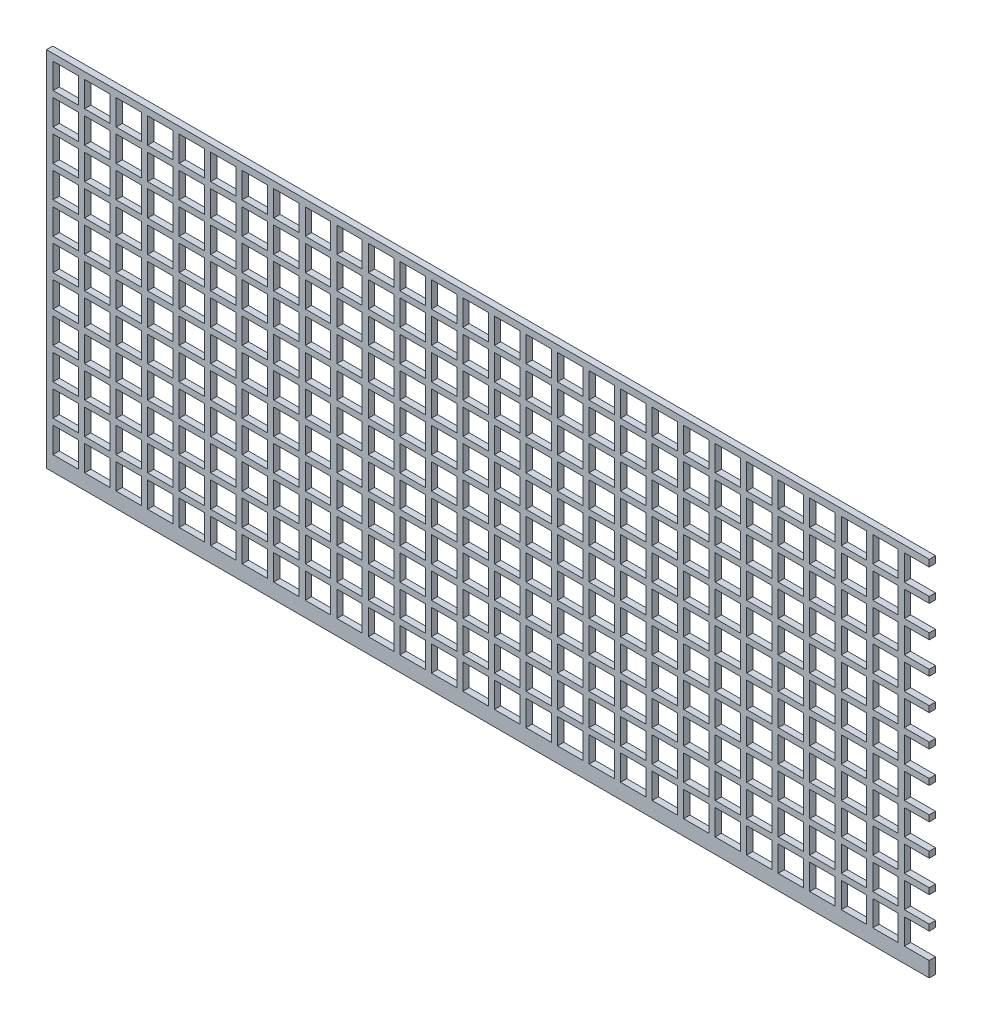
SolidWorks part; units mm, degrees
ref_plane "Front Plane" through (0, 0, 0) normal (0, 0, 1) x (1, 0, 0)
ref_plane "Top Plane" through (0, 0, 0) normal (0, 1, 0) x (1, 0, 0)
ref_plane "Right Plane" through (0, 0, 0) normal (1, 0, 0) x (0, 0, -1)
sketch "Sketch1" plane through (0, 0, 0) normal (0, 0, 1) x (1, 0, 0)
  line L0 (15.3541, 143.3482) -> (25.6075, 143.3482)
  line L1 (0, 0) -> (355.6, 0)
  line L2 (0, 0) -> (0, 146.05)
  line L3 (0, 146.05) -> (355.6, 146.05)
  line L4 (355.6, 0) -> (355.6, 146.05)
  line L5 (2.6541, 143.3482) -> (12.9075, 143.3482)
  line L6 (2.6541, 143.3482) -> (2.6541, 133.0948)
  line L7 (2.6541, 133.0948) -> (12.9075, 133.0948)
  line L8 (12.9075, 143.3482) -> (12.9075, 133.0948)
  line L9 (15.3541, 143.3482) -> (15.3541, 133.0948)
  line L10 (15.3541, 133.0948) -> (25.6075, 133.0948)
  line L11 (25.6075, 143.3482) -> (25.6075, 133.0948)
  line L12 (28.0541, 143.3482) -> (38.3075, 143.3482)
  line L13 (28.0541, 143.3482) -> (28.0541, 133.0948)
  line L14 (28.0541, 133.0948) -> (38.3075, 133.0948)
  line L15 (38.3075, 143.3482) -> (38.3075, 133.0948)
  line L16 (40.7541, 143.3482) -> (51.0075, 143.3482)
  line L17 (40.7541, 143.3482) -> (40.7541, 133.0948)
  line L18 (40.7541, 133.0948) -> (51.0075, 133.0948)
  line L19 (51.0075, 143.3482) -> (51.0075, 133.0948)
  line L20 (53.4541, 143.3482) -> (63.7075, 143.3482)
  line L21 (53.4541, 143.3482) -> (53.4541, 133.0948)
  line L22 (53.4541, 133.0948) -> (63.7075, 133.0948)
  line L23 (63.7075, 143.3482) -> (63.7075, 133.0948)
  line L24 (66.1541, 143.3482) -> (76.4075, 143.3482)
  line L25 (66.1541, 143.3482) -> (66.1541, 133.0948)
  line L26 (66.1541, 133.0948) -> (76.4075, 133.0948)
  line L27 (76.4075, 143.3482) -> (76.4075, 133.0948)
  line L28 (78.8541, 143.3482) -> (89.1075, 143.3482)
  line L29 (78.8541, 143.3482) -> (78.8541, 133.0948)
  line L30 (78.8541, 133.0948) -> (89.1075, 133.0948)
  line L31 (89.1075, 143.3482) -> (89.1075, 133.0948)
  line L32 (91.5541, 143.3482) -> (101.8075, 143.3482)
  line L33 (91.5541, 143.3482) -> (91.5541, 133.0948)
  line L34 (91.5541, 133.0948) -> (101.8075, 133.0948)
  line L35 (101.8075, 143.3482) -> (101.8075, 133.0948)
  line L36 (104.2541, 143.3482) -> (114.5075, 143.3482)
  line L37 (104.2541, 143.3482) -> (104.2541, 133.0948)
  line L38 (104.2541, 133.0948) -> (114.5075, 133.0948)
  line L39 (114.5075, 143.3482) -> (114.5075, 133.0948)
  line L40 (116.9541, 143.3482) -> (127.2075, 143.3482)
  line L41 (116.9541, 143.3482) -> (116.9541, 133.0948)
  line L42 (116.9541, 133.0948) -> (127.2075, 133.0948)
  line L43 (127.2075, 143.3482) -> (127.2075, 133.0948)
  line L44 (129.6541, 143.3482) -> (139.9075, 143.3482)
  line L45 (129.6541, 143.3482) -> (129.6541, 133.0948)
  line L46 (129.6541, 133.0948) -> (139.9075, 133.0948)
  line L47 (139.9075, 143.3482) -> (139.9075, 133.0948)
  line L48 (142.3541, 143.3482) -> (152.6075, 143.3482)
  line L49 (142.3541, 143.3482) -> (142.3541, 133.0948)
  line L50 (142.3541, 133.0948) -> (152.6075, 133.0948)
  line L51 (152.6075, 143.3482) -> (152.6075, 133.0948)
  line L52 (155.0541, 143.3482) -> (165.3075, 143.3482)
  line L53 (155.0541, 143.3482) -> (155.0541, 133.0948)
  line L54 (155.0541, 133.0948) -> (165.3075, 133.0948)
  line L55 (165.3075, 143.3482) -> (165.3075, 133.0948)
  line L56 (167.7541, 143.3482) -> (178.0075, 143.3482)
  line L57 (167.7541, 143.3482) -> (167.7541, 133.0948)
  line L58 (167.7541, 133.0948) -> (178.0075, 133.0948)
  line L59 (178.0075, 143.3482) -> (178.0075, 133.0948)
  line L60 (180.4541, 143.3482) -> (190.7075, 143.3482)
  line L61 (180.4541, 143.3482) -> (180.4541, 133.0948)
  line L62 (180.4541, 133.0948) -> (190.7075, 133.0948)
  line L63 (190.7075, 143.3482) -> (190.7075, 133.0948)
  line L64 (193.1541, 143.3482) -> (203.4075, 143.3482)
  line L65 (193.1541, 143.3482) -> (193.1541, 133.0948)
  line L66 (193.1541, 133.0948) -> (203.4075, 133.0948)
  line L67 (203.4075, 143.3482) -> (203.4075, 133.0948)
  line L68 (205.8541, 143.3482) -> (216.1075, 143.3482)
  line L69 (205.8541, 143.3482) -> (205.8541, 133.0948)
  line L70 (205.8541, 133.0948) -> (216.1075, 133.0948)
  line L71 (216.1075, 143.3482) -> (216.1075, 133.0948)
  line L72 (218.5541, 143.3482) -> (228.8075, 143.3482)
  line L73 (218.5541, 143.3482) -> (218.5541, 133.0948)
  line L74 (218.5541, 133.0948) -> (228.8075, 133.0948)
  line L75 (228.8075, 143.3482) -> (228.8075, 133.0948)
  line L76 (231.2541, 143.3482) -> (241.5075, 143.3482)
  line L77 (231.2541, 143.3482) -> (231.2541, 133.0948)
  line L78 (231.2541, 133.0948) -> (241.5075, 133.0948)
  line L79 (241.5075, 143.3482) -> (241.5075, 133.0948)
  line L80 (243.9541, 143.3482) -> (254.2075, 143.3482)
  line L81 (243.9541, 143.3482) -> (243.9541, 133.0948)
  line L82 (243.9541, 133.0948) -> (254.2075, 133.0948)
  line L83 (254.2075, 143.3482) -> (254.2075, 133.0948)
  line L84 (256.6541, 143.3482) -> (266.9075, 143.3482)
  line L85 (256.6541, 143.3482) -> (256.6541, 133.0948)
  line L86 (256.6541, 133.0948) -> (266.9075, 133.0948)
  line L87 (266.9075, 143.3482) -> (266.9075, 133.0948)
  line L88 (269.3541, 143.3482) -> (279.6075, 143.3482)
  line L89 (269.3541, 143.3482) -> (269.3541, 133.0948)
  line L90 (269.3541, 133.0948) -> (279.6075, 133.0948)
  line L91 (279.6075, 143.3482) -> (279.6075, 133.0948)
  line L92 (282.0541, 143.3482) -> (292.3075, 143.3482)
  line L93 (282.0541, 143.3482) -> (282.0541, 133.0948)
  line L94 (282.0541, 133.0948) -> (292.3075, 133.0948)
  line L95 (292.3075, 143.3482) -> (292.3075, 133.0948)
  line L96 (294.7541, 143.3482) -> (305.0075, 143.3482)
  line L97 (294.7541, 143.3482) -> (294.7541, 133.0948)
  line L98 (294.7541, 133.0948) -> (305.0075, 133.0948)
  line L99 (305.0075, 143.3482) -> (305.0075, 133.0948)
  line L100 (307.4541, 143.3482) -> (317.7075, 143.3482)
  line L101 (307.4541, 143.3482) -> (307.4541, 133.0948)
  line L102 (307.4541, 133.0948) -> (317.7075, 133.0948)
  line L103 (317.7075, 143.3482) -> (317.7075, 133.0948)
  line L104 (320.1541, 143.3482) -> (330.4075, 143.3482)
  line L105 (320.1541, 143.3482) -> (320.1541, 133.0948)
  line L106 (320.1541, 133.0948) -> (330.4075, 133.0948)
  line L107 (330.4075, 143.3482) -> (330.4075, 133.0948)
  line L108 (332.8541, 143.3482) -> (343.1075, 143.3482)
  line L109 (332.8541, 143.3482) -> (332.8541, 133.0948)
  line L110 (332.8541, 133.0948) -> (343.1075, 133.0948)
  line L111 (343.1075, 143.3482) -> (343.1075, 133.0948)
  line L112 (345.5541, 143.3482) -> (355.8075, 143.3482)
  line L113 (345.5541, 143.3482) -> (345.5541, 133.0948)
  line L114 (345.5541, 133.0948) -> (355.8075, 133.0948)
  line L115 (355.8075, 143.3482) -> (355.8075, 133.0948)
  line L116 (15.3541, 130.6482) -> (25.6075, 130.6482)
  line L117 (15.3541, 130.6482) -> (15.3541, 120.3948)
  line L118 (15.3541, 120.3948) -> (25.6075, 120.3948)
  line L119 (25.6075, 130.6482) -> (25.6075, 120.3948)
  line L120 (28.0541, 130.6482) -> (38.3075, 130.6482)
  line L121 (28.0541, 130.6482) -> (28.0541, 120.3948)
  line L122 (28.0541, 120.3948) -> (38.3075, 120.3948)
  line L123 (38.3075, 130.6482) -> (38.3075, 120.3948)
  line L124 (40.7541, 130.6482) -> (51.0075, 130.6482)
  line L125 (40.7541, 130.6482) -> (40.7541, 120.3948)
  line L126 (40.7541, 120.3948) -> (51.0075, 120.3948)
  line L127 (51.0075, 130.6482) -> (51.0075, 120.3948)
  line L128 (53.4541, 130.6482) -> (63.7075, 130.6482)
  line L129 (53.4541, 130.6482) -> (53.4541, 120.3948)
  line L130 (53.4541, 120.3948) -> (63.7075, 120.3948)
  line L131 (63.7075, 130.6482) -> (63.7075, 120.3948)
  line L132 (66.1541, 130.6482) -> (76.4075, 130.6482)
  line L133 (66.1541, 130.6482) -> (66.1541, 120.3948)
  line L134 (66.1541, 120.3948) -> (76.4075, 120.3948)
  line L135 (76.4075, 130.6482) -> (76.4075, 120.3948)
  line L136 (78.8541, 130.6482) -> (89.1075, 130.6482)
  line L137 (78.8541, 130.6482) -> (78.8541, 120.3948)
  line L138 (78.8541, 120.3948) -> (89.1075, 120.3948)
  line L139 (89.1075, 130.6482) -> (89.1075, 120.3948)
  line L140 (91.5541, 130.6482) -> (101.8075, 130.6482)
  line L141 (91.5541, 130.6482) -> (91.5541, 120.3948)
  line L142 (91.5541, 120.3948) -> (101.8075, 120.3948)
  line L143 (101.8075, 130.6482) -> (101.8075, 120.3948)
  line L144 (104.2541, 130.6482) -> (114.5075, 130.6482)
  line L145 (104.2541, 130.6482) -> (104.2541, 120.3948)
  line L146 (104.2541, 120.3948) -> (114.5075, 120.3948)
  line L147 (114.5075, 130.6482) -> (114.5075, 120.3948)
  line L148 (116.9541, 130.6482) -> (127.2075, 130.6482)
  line L149 (116.9541, 130.6482) -> (116.9541, 120.3948)
  line L150 (116.9541, 120.3948) -> (127.2075, 120.3948)
  line L151 (127.2075, 130.6482) -> (127.2075, 120.3948)
  line L152 (129.6541, 130.6482) -> (139.9075, 130.6482)
  line L153 (129.6541, 130.6482) -> (129.6541, 120.3948)
  line L154 (129.6541, 120.3948) -> (139.9075, 120.3948)
  line L155 (139.9075, 130.6482) -> (139.9075, 120.3948)
  line L156 (142.3541, 130.6482) -> (152.6075, 130.6482)
  line L157 (142.3541, 130.6482) -> (142.3541, 120.3948)
  line L158 (142.3541, 120.3948) -> (152.6075, 120.3948)
  line L159 (152.6075, 130.6482) -> (152.6075, 120.3948)
  line L160 (155.0541, 130.6482) -> (165.3075, 130.6482)
  line L161 (155.0541, 130.6482) -> (155.0541, 120.3948)
  line L162 (155.0541, 120.3948) -> (165.3075, 120.3948)
  line L163 (165.3075, 130.6482) -> (165.3075, 120.3948)
  line L164 (167.7541, 130.6482) -> (178.0075, 130.6482)
  line L165 (167.7541, 130.6482) -> (167.7541, 120.3948)
  line L166 (167.7541, 120.3948) -> (178.0075, 120.3948)
  line L167 (178.0075, 130.6482) -> (178.0075, 120.3948)
  line L168 (180.4541, 130.6482) -> (190.7075, 130.6482)
  line L169 (180.4541, 130.6482) -> (180.4541, 120.3948)
  line L170 (180.4541, 120.3948) -> (190.7075, 120.3948)
  line L171 (190.7075, 130.6482) -> (190.7075, 120.3948)
  line L172 (193.1541, 130.6482) -> (203.4075, 130.6482)
  line L173 (193.1541, 130.6482) -> (193.1541, 120.3948)
  line L174 (193.1541, 120.3948) -> (203.4075, 120.3948)
  line L175 (203.4075, 130.6482) -> (203.4075, 120.3948)
  line L176 (205.8541, 130.6482) -> (216.1075, 130.6482)
  line L177 (205.8541, 130.6482) -> (205.8541, 120.3948)
  line L178 (205.8541, 120.3948) -> (216.1075, 120.3948)
  line L179 (216.1075, 130.6482) -> (216.1075, 120.3948)
  line L180 (218.5541, 130.6482) -> (228.8075, 130.6482)
  line L181 (218.5541, 130.6482) -> (218.5541, 120.3948)
  line L182 (218.5541, 120.3948) -> (228.8075, 120.3948)
  line L183 (228.8075, 130.6482) -> (228.8075, 120.3948)
  line L184 (231.2541, 130.6482) -> (241.5075, 130.6482)
  line L185 (231.2541, 130.6482) -> (231.2541, 120.3948)
  line L186 (231.2541, 120.3948) -> (241.5075, 120.3948)
  line L187 (241.5075, 130.6482) -> (241.5075, 120.3948)
  line L188 (243.9541, 130.6482) -> (254.2075, 130.6482)
  line L189 (243.9541, 130.6482) -> (243.9541, 120.3948)
  line L190 (243.9541, 120.3948) -> (254.2075, 120.3948)
  line L191 (254.2075, 130.6482) -> (254.2075, 120.3948)
  line L192 (256.6541, 130.6482) -> (266.9075, 130.6482)
  line L193 (256.6541, 130.6482) -> (256.6541, 120.3948)
  line L194 (256.6541, 120.3948) -> (266.9075, 120.3948)
  line L195 (266.9075, 130.6482) -> (266.9075, 120.3948)
  line L196 (269.3541, 130.6482) -> (279.6075, 130.6482)
  line L197 (269.3541, 130.6482) -> (269.3541, 120.3948)
  line L198 (269.3541, 120.3948) -> (279.6075, 120.3948)
  line L199 (279.6075, 130.6482) -> (279.6075, 120.3948)
  line L200 (282.0541, 130.6482) -> (292.3075, 130.6482)
  line L201 (282.0541, 130.6482) -> (282.0541, 120.3948)
  line L202 (282.0541, 120.3948) -> (292.3075, 120.3948)
  line L203 (292.3075, 130.6482) -> (292.3075, 120.3948)
  line L204 (294.7541, 130.6482) -> (305.0075, 130.6482)
  line L205 (294.7541, 130.6482) -> (294.7541, 120.3948)
  line L206 (294.7541, 120.3948) -> (305.0075, 120.3948)
  line L207 (305.0075, 130.6482) -> (305.0075, 120.3948)
  line L208 (307.4541, 130.6482) -> (317.7075, 130.6482)
  line L209 (307.4541, 130.6482) -> (307.4541, 120.3948)
  line L210 (307.4541, 120.3948) -> (317.7075, 120.3948)
  line L211 (317.7075, 130.6482) -> (317.7075, 120.3948)
  line L212 (320.1541, 130.6482) -> (330.4075, 130.6482)
  line L213 (320.1541, 130.6482) -> (320.1541, 120.3948)
  line L214 (320.1541, 120.3948) -> (330.4075, 120.3948)
  line L215 (330.4075, 130.6482) -> (330.4075, 120.3948)
  line L216 (332.8541, 130.6482) -> (343.1075, 130.6482)
  line L217 (332.8541, 130.6482) -> (332.8541, 120.3948)
  line L218 (332.8541, 120.3948) -> (343.1075, 120.3948)
  line L219 (343.1075, 130.6482) -> (343.1075, 120.3948)
  line L220 (345.5541, 130.6482) -> (355.8075, 130.6482)
  line L221 (345.5541, 130.6482) -> (345.5541, 120.3948)
  line L222 (345.5541, 120.3948) -> (355.8075, 120.3948)
  line L223 (355.8075, 130.6482) -> (355.8075, 120.3948)
  line L224 (15.3541, 117.9482) -> (25.6075, 117.9482)
  line L225 (15.3541, 117.9482) -> (15.3541, 107.6948)
  line L226 (15.3541, 107.6948) -> (25.6075, 107.6948)
  line L227 (25.6075, 117.9482) -> (25.6075, 107.6948)
  line L228 (28.0541, 117.9482) -> (38.3075, 117.9482)
  line L229 (28.0541, 117.9482) -> (28.0541, 107.6948)
  line L230 (28.0541, 107.6948) -> (38.3075, 107.6948)
  line L231 (38.3075, 117.9482) -> (38.3075, 107.6948)
  line L232 (40.7541, 117.9482) -> (51.0075, 117.9482)
  line L233 (40.7541, 117.9482) -> (40.7541, 107.6948)
  line L234 (40.7541, 107.6948) -> (51.0075, 107.6948)
  line L235 (51.0075, 117.9482) -> (51.0075, 107.6948)
  line L236 (53.4541, 117.9482) -> (63.7075, 117.9482)
  line L237 (53.4541, 117.9482) -> (53.4541, 107.6948)
  line L238 (53.4541, 107.6948) -> (63.7075, 107.6948)
  line L239 (63.7075, 117.9482) -> (63.7075, 107.6948)
  line L240 (66.1541, 117.9482) -> (76.4075, 117.9482)
  line L241 (66.1541, 117.9482) -> (66.1541, 107.6948)
  line L242 (66.1541, 107.6948) -> (76.4075, 107.6948)
  line L243 (76.4075, 117.9482) -> (76.4075, 107.6948)
  line L244 (78.8541, 117.9482) -> (89.1075, 117.9482)
  line L245 (78.8541, 117.9482) -> (78.8541, 107.6948)
  line L246 (78.8541, 107.6948) -> (89.1075, 107.6948)
  line L247 (89.1075, 117.9482) -> (89.1075, 107.6948)
  line L248 (91.5541, 117.9482) -> (101.8075, 117.9482)
  line L249 (91.5541, 117.9482) -> (91.5541, 107.6948)
  line L250 (91.5541, 107.6948) -> (101.8075, 107.6948)
  line L251 (101.8075, 117.9482) -> (101.8075, 107.6948)
  line L252 (104.2541, 117.9482) -> (114.5075, 117.9482)
  line L253 (104.2541, 117.9482) -> (104.2541, 107.6948)
  line L254 (104.2541, 107.6948) -> (114.5075, 107.6948)
  line L255 (114.5075, 117.9482) -> (114.5075, 107.6948)
  line L256 (116.9541, 117.9482) -> (127.2075, 117.9482)
  line L257 (116.9541, 117.9482) -> (116.9541, 107.6948)
  line L258 (116.9541, 107.6948) -> (127.2075, 107.6948)
  line L259 (127.2075, 117.9482) -> (127.2075, 107.6948)
  line L260 (129.6541, 117.9482) -> (139.9075, 117.9482)
  line L261 (129.6541, 117.9482) -> (129.6541, 107.6948)
  line L262 (129.6541, 107.6948) -> (139.9075, 107.6948)
  line L263 (139.9075, 117.9482) -> (139.9075, 107.6948)
  line L264 (142.3541, 117.9482) -> (152.6075, 117.9482)
  line L265 (142.3541, 117.9482) -> (142.3541, 107.6948)
  line L266 (142.3541, 107.6948) -> (152.6075, 107.6948)
  line L267 (152.6075, 117.9482) -> (152.6075, 107.6948)
  line L268 (155.0541, 117.9482) -> (165.3075, 117.9482)
  line L269 (155.0541, 117.9482) -> (155.0541, 107.6948)
  line L270 (155.0541, 107.6948) -> (165.3075, 107.6948)
  line L271 (165.3075, 117.9482) -> (165.3075, 107.6948)
  line L272 (167.7541, 117.9482) -> (178.0075, 117.9482)
  line L273 (167.7541, 117.9482) -> (167.7541, 107.6948)
  line L274 (167.7541, 107.6948) -> (178.0075, 107.6948)
  line L275 (178.0075, 117.9482) -> (178.0075, 107.6948)
  line L276 (180.4541, 117.9482) -> (190.7075, 117.9482)
  line L277 (180.4541, 117.9482) -> (180.4541, 107.6948)
  line L278 (180.4541, 107.6948) -> (190.7075, 107.6948)
  line L279 (190.7075, 117.9482) -> (190.7075, 107.6948)
  line L280 (193.1541, 117.9482) -> (203.4075, 117.9482)
  line L281 (193.1541, 117.9482) -> (193.1541, 107.6948)
  line L282 (193.1541, 107.6948) -> (203.4075, 107.6948)
  line L283 (203.4075, 117.9482) -> (203.4075, 107.6948)
  line L284 (205.8541, 117.9482) -> (216.1075, 117.9482)
  line L285 (205.8541, 117.9482) -> (205.8541, 107.6948)
  line L286 (205.8541, 107.6948) -> (216.1075, 107.6948)
  line L287 (216.1075, 117.9482) -> (216.1075, 107.6948)
  line L288 (218.5541, 117.9482) -> (228.8075, 117.9482)
  line L289 (218.5541, 117.9482) -> (218.5541, 107.6948)
  line L290 (218.5541, 107.6948) -> (228.8075, 107.6948)
  line L291 (228.8075, 117.9482) -> (228.8075, 107.6948)
  line L292 (231.2541, 117.9482) -> (241.5075, 117.9482)
  line L293 (231.2541, 117.9482) -> (231.2541, 107.6948)
  line L294 (231.2541, 107.6948) -> (241.5075, 107.6948)
  line L295 (241.5075, 117.9482) -> (241.5075, 107.6948)
  line L296 (243.9541, 117.9482) -> (254.2075, 117.9482)
  line L297 (243.9541, 117.9482) -> (243.9541, 107.6948)
  line L298 (243.9541, 107.6948) -> (254.2075, 107.6948)
  line L299 (254.2075, 117.9482) -> (254.2075, 107.6948)
  line L300 (256.6541, 117.9482) -> (266.9075, 117.9482)
  line L301 (256.6541, 117.9482) -> (256.6541, 107.6948)
  line L302 (256.6541, 107.6948) -> (266.9075, 107.6948)
  line L303 (266.9075, 117.9482) -> (266.9075, 107.6948)
  line L304 (269.3541, 117.9482) -> (279.6075, 117.9482)
  line L305 (269.3541, 117.9482) -> (269.3541, 107.6948)
  line L306 (269.3541, 107.6948) -> (279.6075, 107.6948)
  line L307 (279.6075, 117.9482) -> (279.6075, 107.6948)
  line L308 (282.0541, 117.9482) -> (292.3075, 117.9482)
  line L309 (282.0541, 117.9482) -> (282.0541, 107.6948)
  line L310 (282.0541, 107.6948) -> (292.3075, 107.6948)
  line L311 (292.3075, 117.9482) -> (292.3075, 107.6948)
  line L312 (294.7541, 117.9482) -> (305.0075, 117.9482)
  line L313 (294.7541, 117.9482) -> (294.7541, 107.6948)
  line L314 (294.7541, 107.6948) -> (305.0075, 107.6948)
  line L315 (305.0075, 117.9482) -> (305.0075, 107.6948)
  line L316 (307.4541, 117.9482) -> (317.7075, 117.9482)
  line L317 (307.4541, 117.9482) -> (307.4541, 107.6948)
  line L318 (307.4541, 107.6948) -> (317.7075, 107.6948)
  line L319 (317.7075, 117.9482) -> (317.7075, 107.6948)
  line L320 (320.1541, 117.9482) -> (330.4075, 117.9482)
  line L321 (320.1541, 117.9482) -> (320.1541, 107.6948)
  line L322 (320.1541, 107.6948) -> (330.4075, 107.6948)
  line L323 (330.4075, 117.9482) -> (330.4075, 107.6948)
  line L324 (332.8541, 117.9482) -> (343.1075, 117.9482)
  line L325 (332.8541, 117.9482) -> (332.8541, 107.6948)
  line L326 (332.8541, 107.6948) -> (343.1075, 107.6948)
  line L327 (343.1075, 117.9482) -> (343.1075, 107.6948)
  line L328 (345.5541, 117.9482) -> (355.8075, 117.9482)
  line L329 (345.5541, 117.9482) -> (345.5541, 107.6948)
  line L330 (345.5541, 107.6948) -> (355.8075, 107.6948)
  line L331 (355.8075, 117.9482) -> (355.8075, 107.6948)
  line L332 (15.3541, 105.2482) -> (25.6075, 105.2482)
  line L333 (15.3541, 105.2482) -> (15.3541, 94.9948)
  line L334 (15.3541, 94.9948) -> (25.6075, 94.9948)
  line L335 (25.6075, 105.2482) -> (25.6075, 94.9948)
  line L336 (28.0541, 105.2482) -> (38.3075, 105.2482)
  line L337 (28.0541, 105.2482) -> (28.0541, 94.9948)
  line L338 (28.0541, 94.9948) -> (38.3075, 94.9948)
  line L339 (38.3075, 105.2482) -> (38.3075, 94.9948)
  line L340 (40.7541, 105.2482) -> (51.0075, 105.2482)
  line L341 (40.7541, 105.2482) -> (40.7541, 94.9948)
  line L342 (40.7541, 94.9948) -> (51.0075, 94.9948)
  line L343 (51.0075, 105.2482) -> (51.0075, 94.9948)
  line L344 (53.4541, 105.2482) -> (63.7075, 105.2482)
  line L345 (53.4541, 105.2482) -> (53.4541, 94.9948)
  line L346 (53.4541, 94.9948) -> (63.7075, 94.9948)
  line L347 (63.7075, 105.2482) -> (63.7075, 94.9948)
  line L348 (66.1541, 105.2482) -> (76.4075, 105.2482)
  line L349 (66.1541, 105.2482) -> (66.1541, 94.9948)
  line L350 (66.1541, 94.9948) -> (76.4075, 94.9948)
  line L351 (76.4075, 105.2482) -> (76.4075, 94.9948)
  line L352 (78.8541, 105.2482) -> (89.1075, 105.2482)
  line L353 (78.8541, 105.2482) -> (78.8541, 94.9948)
  line L354 (78.8541, 94.9948) -> (89.1075, 94.9948)
  line L355 (89.1075, 105.2482) -> (89.1075, 94.9948)
  line L356 (91.5541, 105.2482) -> (101.8075, 105.2482)
  line L357 (91.5541, 105.2482) -> (91.5541, 94.9948)
  line L358 (91.5541, 94.9948) -> (101.8075, 94.9948)
  line L359 (101.8075, 105.2482) -> (101.8075, 94.9948)
  line L360 (104.2541, 105.2482) -> (114.5075, 105.2482)
  line L361 (104.2541, 105.2482) -> (104.2541, 94.9948)
  line L362 (104.2541, 94.9948) -> (114.5075, 94.9948)
  line L363 (114.5075, 105.2482) -> (114.5075, 94.9948)
  line L364 (116.9541, 105.2482) -> (127.2075, 105.2482)
  line L365 (116.9541, 105.2482) -> (116.9541, 94.9948)
  line L366 (116.9541, 94.9948) -> (127.2075, 94.9948)
  line L367 (127.2075, 105.2482) -> (127.2075, 94.9948)
  line L368 (129.6541, 105.2482) -> (139.9075, 105.2482)
  line L369 (129.6541, 105.2482) -> (129.6541, 94.9948)
  line L370 (129.6541, 94.9948) -> (139.9075, 94.9948)
  line L371 (139.9075, 105.2482) -> (139.9075, 94.9948)
  line L372 (142.3541, 105.2482) -> (152.6075, 105.2482)
  line L373 (142.3541, 105.2482) -> (142.3541, 94.9948)
  line L374 (142.3541, 94.9948) -> (152.6075, 94.9948)
  line L375 (152.6075, 105.2482) -> (152.6075, 94.9948)
  line L376 (155.0541, 105.2482) -> (165.3075, 105.2482)
  line L377 (155.0541, 105.2482) -> (155.0541, 94.9948)
  line L378 (155.0541, 94.9948) -> (165.3075, 94.9948)
  line L379 (165.3075, 105.2482) -> (165.3075, 94.9948)
  line L380 (167.7541, 105.2482) -> (178.0075, 105.2482)
  line L381 (167.7541, 105.2482) -> (167.7541, 94.9948)
  line L382 (167.7541, 94.9948) -> (178.0075, 94.9948)
  line L383 (178.0075, 105.2482) -> (178.0075, 94.9948)
  line L384 (180.4541, 105.2482) -> (190.7075, 105.2482)
  line L385 (180.4541, 105.2482) -> (180.4541, 94.9948)
  line L386 (180.4541, 94.9948) -> (190.7075, 94.9948)
  line L387 (190.7075, 105.2482) -> (190.7075, 94.9948)
  line L388 (193.1541, 105.2482) -> (203.4075, 105.2482)
  line L389 (193.1541, 105.2482) -> (193.1541, 94.9948)
  line L390 (193.1541, 94.9948) -> (203.4075, 94.9948)
  line L391 (203.4075, 105.2482) -> (203.4075, 94.9948)
  line L392 (205.8541, 105.2482) -> (216.1075, 105.2482)
  line L393 (205.8541, 105.2482) -> (205.8541, 94.9948)
  line L394 (205.8541, 94.9948) -> (216.1075, 94.9948)
  line L395 (216.1075, 105.2482) -> (216.1075, 94.9948)
  line L396 (218.5541, 105.2482) -> (228.8075, 105.2482)
  line L397 (218.5541, 105.2482) -> (218.5541, 94.9948)
  line L398 (218.5541, 94.9948) -> (228.8075, 94.9948)
  line L399 (228.8075, 105.2482) -> (228.8075, 94.9948)
  line L400 (231.2541, 105.2482) -> (241.5075, 105.2482)
  line L401 (231.2541, 105.2482) -> (231.2541, 94.9948)
  line L402 (231.2541, 94.9948) -> (241.5075, 94.9948)
  line L403 (241.5075, 105.2482) -> (241.5075, 94.9948)
  line L404 (243.9541, 105.2482) -> (254.2075, 105.2482)
  line L405 (243.9541, 105.2482) -> (243.9541, 94.9948)
  line L406 (243.9541, 94.9948) -> (254.2075, 94.9948)
  line L407 (254.2075, 105.2482) -> (254.2075, 94.9948)
  line L408 (256.6541, 105.2482) -> (266.9075, 105.2482)
  line L409 (256.6541, 105.2482) -> (256.6541, 94.9948)
  line L410 (256.6541, 94.9948) -> (266.9075, 94.9948)
  line L411 (266.9075, 105.2482) -> (266.9075, 94.9948)
  line L412 (269.3541, 105.2482) -> (279.6075, 105.2482)
  line L413 (269.3541, 105.2482) -> (269.3541, 94.9948)
  line L414 (269.3541, 94.9948) -> (279.6075, 94.9948)
  line L415 (279.6075, 105.2482) -> (279.6075, 94.9948)
  line L416 (282.0541, 105.2482) -> (292.3075, 105.2482)
  line L417 (282.0541, 105.2482) -> (282.0541, 94.9948)
  line L418 (282.0541, 94.9948) -> (292.3075, 94.9948)
  line L419 (292.3075, 105.2482) -> (292.3075, 94.9948)
  line L420 (294.7541, 105.2482) -> (305.0075, 105.2482)
  line L421 (294.7541, 105.2482) -> (294.7541, 94.9948)
  line L422 (294.7541, 94.9948) -> (305.0075, 94.9948)
  line L423 (305.0075, 105.2482) -> (305.0075, 94.9948)
  line L424 (307.4541, 105.2482) -> (317.7075, 105.2482)
  line L425 (307.4541, 105.2482) -> (307.4541, 94.9948)
  line L426 (307.4541, 94.9948) -> (317.7075, 94.9948)
  line L427 (317.7075, 105.2482) -> (317.7075, 94.9948)
  line L428 (320.1541, 105.2482) -> (330.4075, 105.2482)
  line L429 (320.1541, 105.2482) -> (320.1541, 94.9948)
  line L430 (320.1541, 94.9948) -> (330.4075, 94.9948)
  line L431 (330.4075, 105.2482) -> (330.4075, 94.9948)
  line L432 (332.8541, 105.2482) -> (343.1075, 105.2482)
  line L433 (332.8541, 105.2482) -> (332.8541, 94.9948)
  line L434 (332.8541, 94.9948) -> (343.1075, 94.9948)
  line L435 (343.1075, 105.2482) -> (343.1075, 94.9948)
  line L436 (345.5541, 105.2482) -> (355.8075, 105.2482)
  line L437 (345.5541, 105.2482) -> (345.5541, 94.9948)
  line L438 (345.5541, 94.9948) -> (355.8075, 94.9948)
  line L439 (355.8075, 105.2482) -> (355.8075, 94.9948)
  line L440 (15.3541, 92.5482) -> (25.6075, 92.5482)
  line L441 (15.3541, 92.5482) -> (15.3541, 82.2948)
  line L442 (15.3541, 82.2948) -> (25.6075, 82.2948)
  line L443 (25.6075, 92.5482) -> (25.6075, 82.2948)
  line L444 (28.0541, 92.5482) -> (38.3075, 92.5482)
  line L445 (28.0541, 92.5482) -> (28.0541, 82.2948)
  line L446 (28.0541, 82.2948) -> (38.3075, 82.2948)
  line L447 (38.3075, 92.5482) -> (38.3075, 82.2948)
  line L448 (40.7541, 92.5482) -> (51.0075, 92.5482)
  line L449 (40.7541, 92.5482) -> (40.7541, 82.2948)
  line L450 (40.7541, 82.2948) -> (51.0075, 82.2948)
  line L451 (51.0075, 92.5482) -> (51.0075, 82.2948)
  line L452 (53.4541, 92.5482) -> (63.7075, 92.5482)
  line L453 (53.4541, 92.5482) -> (53.4541, 82.2948)
  line L454 (53.4541, 82.2948) -> (63.7075, 82.2948)
  line L455 (63.7075, 92.5482) -> (63.7075, 82.2948)
  line L456 (66.1541, 92.5482) -> (76.4075, 92.5482)
  line L457 (66.1541, 92.5482) -> (66.1541, 82.2948)
  line L458 (66.1541, 82.2948) -> (76.4075, 82.2948)
  line L459 (76.4075, 92.5482) -> (76.4075, 82.2948)
  line L460 (78.8541, 92.5482) -> (89.1075, 92.5482)
  line L461 (78.8541, 92.5482) -> (78.8541, 82.2948)
  line L462 (78.8541, 82.2948) -> (89.1075, 82.2948)
  line L463 (89.1075, 92.5482) -> (89.1075, 82.2948)
  line L464 (91.5541, 92.5482) -> (101.8075, 92.5482)
  line L465 (91.5541, 92.5482) -> (91.5541, 82.2948)
  line L466 (91.5541, 82.2948) -> (101.8075, 82.2948)
  line L467 (101.8075, 92.5482) -> (101.8075, 82.2948)
  line L468 (104.2541, 92.5482) -> (114.5075, 92.5482)
  line L469 (104.2541, 92.5482) -> (104.2541, 82.2948)
  line L470 (104.2541, 82.2948) -> (114.5075, 82.2948)
  line L471 (114.5075, 92.5482) -> (114.5075, 82.2948)
  line L472 (116.9541, 92.5482) -> (127.2075, 92.5482)
  line L473 (116.9541, 92.5482) -> (116.9541, 82.2948)
  line L474 (116.9541, 82.2948) -> (127.2075, 82.2948)
  line L475 (127.2075, 92.5482) -> (127.2075, 82.2948)
  line L476 (129.6541, 92.5482) -> (139.9075, 92.5482)
  line L477 (129.6541, 92.5482) -> (129.6541, 82.2948)
  line L478 (129.6541, 82.2948) -> (139.9075, 82.2948)
  line L479 (139.9075, 92.5482) -> (139.9075, 82.2948)
  line L480 (142.3541, 92.5482) -> (152.6075, 92.5482)
  line L481 (142.3541, 92.5482) -> (142.3541, 82.2948)
  line L482 (142.3541, 82.2948) -> (152.6075, 82.2948)
  line L483 (152.6075, 92.5482) -> (152.6075, 82.2948)
  line L484 (155.0541, 92.5482) -> (165.3075, 92.5482)
  line L485 (155.0541, 92.5482) -> (155.0541, 82.2948)
  line L486 (155.0541, 82.2948) -> (165.3075, 82.2948)
  line L487 (165.3075, 92.5482) -> (165.3075, 82.2948)
  line L488 (167.7541, 92.5482) -> (178.0075, 92.5482)
  line L489 (167.7541, 92.5482) -> (167.7541, 82.2948)
  line L490 (167.7541, 82.2948) -> (178.0075, 82.2948)
  line L491 (178.0075, 92.5482) -> (178.0075, 82.2948)
  line L492 (180.4541, 92.5482) -> (190.7075, 92.5482)
  line L493 (180.4541, 92.5482) -> (180.4541, 82.2948)
  line L494 (180.4541, 82.2948) -> (190.7075, 82.2948)
  line L495 (190.7075, 92.5482) -> (190.7075, 82.2948)
  line L496 (193.1541, 92.5482) -> (203.4075, 92.5482)
  line L497 (193.1541, 92.5482) -> (193.1541, 82.2948)
  line L498 (193.1541, 82.2948) -> (203.4075, 82.2948)
  line L499 (203.4075, 92.5482) -> (203.4075, 82.2948)
  line L500 (205.8541, 92.5482) -> (216.1075, 92.5482)
  line L501 (205.8541, 92.5482) -> (205.8541, 82.2948)
  line L502 (205.8541, 82.2948) -> (216.1075, 82.2948)
  line L503 (216.1075, 92.5482) -> (216.1075, 82.2948)
  line L504 (218.5541, 92.5482) -> (228.8075, 92.5482)
  line L505 (218.5541, 92.5482) -> (218.5541, 82.2948)
  line L506 (218.5541, 82.2948) -> (228.8075, 82.2948)
  line L507 (228.8075, 92.5482) -> (228.8075, 82.2948)
  line L508 (231.2541, 92.5482) -> (241.5075, 92.5482)
  line L509 (231.2541, 92.5482) -> (231.2541, 82.2948)
  line L510 (231.2541, 82.2948) -> (241.5075, 82.2948)
  line L511 (241.5075, 92.5482) -> (241.5075, 82.2948)
  line L512 (243.9541, 92.5482) -> (254.2075, 92.5482)
  line L513 (243.9541, 92.5482) -> (243.9541, 82.2948)
  line L514 (243.9541, 82.2948) -> (254.2075, 82.2948)
  line L515 (254.2075, 92.5482) -> (254.2075, 82.2948)
  line L516 (256.6541, 92.5482) -> (266.9075, 92.5482)
  line L517 (256.6541, 92.5482) -> (256.6541, 82.2948)
  line L518 (256.6541, 82.2948) -> (266.9075, 82.2948)
  line L519 (266.9075, 92.5482) -> (266.9075, 82.2948)
  line L520 (269.3541, 92.5482) -> (279.6075, 92.5482)
  line L521 (269.3541, 92.5482) -> (269.3541, 82.2948)
  line L522 (269.3541, 82.2948) -> (279.6075, 82.2948)
  line L523 (279.6075, 92.5482) -> (279.6075, 82.2948)
  line L524 (282.0541, 92.5482) -> (292.3075, 92.5482)
  line L525 (282.0541, 92.5482) -> (282.0541, 82.2948)
  line L526 (282.0541, 82.2948) -> (292.3075, 82.2948)
  line L527 (292.3075, 92.5482) -> (292.3075, 82.2948)
  line L528 (294.7541, 92.5482) -> (305.0075, 92.5482)
  line L529 (294.7541, 92.5482) -> (294.7541, 82.2948)
  line L530 (294.7541, 82.2948) -> (305.0075, 82.2948)
  line L531 (305.0075, 92.5482) -> (305.0075, 82.2948)
  line L532 (307.4541, 92.5482) -> (317.7075, 92.5482)
  line L533 (307.4541, 92.5482) -> (307.4541, 82.2948)
  line L534 (307.4541, 82.2948) -> (317.7075, 82.2948)
  line L535 (317.7075, 92.5482) -> (317.7075, 82.2948)
  line L536 (320.1541, 92.5482) -> (330.4075, 92.5482)
  line L537 (320.1541, 92.5482) -> (320.1541, 82.2948)
  line L538 (320.1541, 82.2948) -> (330.4075, 82.2948)
  line L539 (330.4075, 92.5482) -> (330.4075, 82.2948)
  line L540 (332.8541, 92.5482) -> (343.1075, 92.5482)
  line L541 (332.8541, 92.5482) -> (332.8541, 82.2948)
  line L542 (332.8541, 82.2948) -> (343.1075, 82.2948)
  line L543 (343.1075, 92.5482) -> (343.1075, 82.2948)
  line L544 (345.5541, 92.5482) -> (355.8075, 92.5482)
  line L545 (345.5541, 92.5482) -> (345.5541, 82.2948)
  line L546 (345.5541, 82.2948) -> (355.8075, 82.2948)
  line L547 (355.8075, 92.5482) -> (355.8075, 82.2948)
  line L548 (15.3541, 79.8482) -> (25.6075, 79.8482)
  line L549 (15.3541, 79.8482) -> (15.3541, 69.5948)
  line L550 (15.3541, 69.5948) -> (25.6075, 69.5948)
  line L551 (25.6075, 79.8482) -> (25.6075, 69.5948)
  line L552 (28.0541, 79.8482) -> (38.3075, 79.8482)
  line L553 (28.0541, 79.8482) -> (28.0541, 69.5948)
  line L554 (28.0541, 69.5948) -> (38.3075, 69.5948)
  line L555 (38.3075, 79.8482) -> (38.3075, 69.5948)
  line L556 (40.7541, 79.8482) -> (51.0075, 79.8482)
  line L557 (40.7541, 79.8482) -> (40.7541, 69.5948)
  line L558 (40.7541, 69.5948) -> (51.0075, 69.5948)
  line L559 (51.0075, 79.8482) -> (51.0075, 69.5948)
  line L560 (53.4541, 79.8482) -> (63.7075, 79.8482)
  line L561 (53.4541, 79.8482) -> (53.4541, 69.5948)
  line L562 (53.4541, 69.5948) -> (63.7075, 69.5948)
  line L563 (63.7075, 79.8482) -> (63.7075, 69.5948)
  line L564 (66.1541, 79.8482) -> (76.4075, 79.8482)
  line L565 (66.1541, 79.8482) -> (66.1541, 69.5948)
  line L566 (66.1541, 69.5948) -> (76.4075, 69.5948)
  line L567 (76.4075, 79.8482) -> (76.4075, 69.5948)
  line L568 (78.8541, 79.8482) -> (89.1075, 79.8482)
  line L569 (78.8541, 79.8482) -> (78.8541, 69.5948)
  line L570 (78.8541, 69.5948) -> (89.1075, 69.5948)
  line L571 (89.1075, 79.8482) -> (89.1075, 69.5948)
  line L572 (91.5541, 79.8482) -> (101.8075, 79.8482)
  line L573 (91.5541, 79.8482) -> (91.5541, 69.5948)
  line L574 (91.5541, 69.5948) -> (101.8075, 69.5948)
  line L575 (101.8075, 79.8482) -> (101.8075, 69.5948)
  line L576 (104.2541, 79.8482) -> (114.5075, 79.8482)
  line L577 (104.2541, 79.8482) -> (104.2541, 69.5948)
  line L578 (104.2541, 69.5948) -> (114.5075, 69.5948)
  line L579 (114.5075, 79.8482) -> (114.5075, 69.5948)
  line L580 (116.9541, 79.8482) -> (127.2075, 79.8482)
  line L581 (116.9541, 79.8482) -> (116.9541, 69.5948)
  line L582 (116.9541, 69.5948) -> (127.2075, 69.5948)
  line L583 (127.2075, 79.8482) -> (127.2075, 69.5948)
  line L584 (129.6541, 79.8482) -> (139.9075, 79.8482)
  line L585 (129.6541, 79.8482) -> (129.6541, 69.5948)
  line L586 (129.6541, 69.5948) -> (139.9075, 69.5948)
  line L587 (139.9075, 79.8482) -> (139.9075, 69.5948)
  line L588 (142.3541, 79.8482) -> (152.6075, 79.8482)
  line L589 (142.3541, 79.8482) -> (142.3541, 69.5948)
  line L590 (142.3541, 69.5948) -> (152.6075, 69.5948)
  line L591 (152.6075, 79.8482) -> (152.6075, 69.5948)
  line L592 (155.0541, 79.8482) -> (165.3075, 79.8482)
  line L593 (155.0541, 79.8482) -> (155.0541, 69.5948)
  line L594 (155.0541, 69.5948) -> (165.3075, 69.5948)
  line L595 (165.3075, 79.8482) -> (165.3075, 69.5948)
  line L596 (167.7541, 79.8482) -> (178.0075, 79.8482)
  line L597 (167.7541, 79.8482) -> (167.7541, 69.5948)
  line L598 (167.7541, 69.5948) -> (178.0075, 69.5948)
  line L599 (178.0075, 79.8482) -> (178.0075, 69.5948)
  line L600 (180.4541, 79.8482) -> (190.7075, 79.8482)
  line L601 (180.4541, 79.8482) -> (180.4541, 69.5948)
  line L602 (180.4541, 69.5948) -> (190.7075, 69.5948)
  line L603 (190.7075, 79.8482) -> (190.7075, 69.5948)
  line L604 (193.1541, 79.8482) -> (203.4075, 79.8482)
  line L605 (193.1541, 79.8482) -> (193.1541, 69.5948)
  line L606 (193.1541, 69.5948) -> (203.4075, 69.5948)
  line L607 (203.4075, 79.8482) -> (203.4075, 69.5948)
  line L608 (205.8541, 79.8482) -> (216.1075, 79.8482)
  line L609 (205.8541, 79.8482) -> (205.8541, 69.5948)
  line L610 (205.8541, 69.5948) -> (216.1075, 69.5948)
  line L611 (216.1075, 79.8482) -> (216.1075, 69.5948)
  line L612 (218.5541, 79.8482) -> (228.8075, 79.8482)
  line L613 (218.5541, 79.8482) -> (218.5541, 69.5948)
  line L614 (218.5541, 69.5948) -> (228.8075, 69.5948)
  line L615 (228.8075, 79.8482) -> (228.8075, 69.5948)
  line L616 (231.2541, 79.8482) -> (241.5075, 79.8482)
  line L617 (231.2541, 79.8482) -> (231.2541, 69.5948)
  line L618 (231.2541, 69.5948) -> (241.5075, 69.5948)
  line L619 (241.5075, 79.8482) -> (241.5075, 69.5948)
  line L620 (243.9541, 79.8482) -> (254.2075, 79.8482)
  line L621 (243.9541, 79.8482) -> (243.9541, 69.5948)
  line L622 (243.9541, 69.5948) -> (254.2075, 69.5948)
  line L623 (254.2075, 79.8482) -> (254.2075, 69.5948)
  line L624 (256.6541, 79.8482) -> (266.9075, 79.8482)
  line L625 (256.6541, 79.8482) -> (256.6541, 69.5948)
  line L626 (256.6541, 69.5948) -> (266.9075, 69.5948)
  line L627 (266.9075, 79.8482) -> (266.9075, 69.5948)
  line L628 (269.3541, 79.8482) -> (279.6075, 79.8482)
  line L629 (269.3541, 79.8482) -> (269.3541, 69.5948)
  line L630 (269.3541, 69.5948) -> (279.6075, 69.5948)
  line L631 (279.6075, 79.8482) -> (279.6075, 69.5948)
  line L632 (282.0541, 79.8482) -> (292.3075, 79.8482)
  line L633 (282.0541, 79.8482) -> (282.0541, 69.5948)
  line L634 (282.0541, 69.5948) -> (292.3075, 69.5948)
  line L635 (292.3075, 79.8482) -> (292.3075, 69.5948)
  line L636 (294.7541, 79.8482) -> (305.0075, 79.8482)
  line L637 (294.7541, 79.8482) -> (294.7541, 69.5948)
  line L638 (294.7541, 69.5948) -> (305.0075, 69.5948)
  line L639 (305.0075, 79.8482) -> (305.0075, 69.5948)
  line L640 (307.4541, 79.8482) -> (317.7075, 79.8482)
  line L641 (307.4541, 79.8482) -> (307.4541, 69.5948)
  line L642 (307.4541, 69.5948) -> (317.7075, 69.5948)
  line L643 (317.7075, 79.8482) -> (317.7075, 69.5948)
  line L644 (320.1541, 79.8482) -> (330.4075, 79.8482)
  line L645 (320.1541, 79.8482) -> (320.1541, 69.5948)
  line L646 (320.1541, 69.5948) -> (330.4075, 69.5948)
  line L647 (330.4075, 79.8482) -> (330.4075, 69.5948)
  line L648 (332.8541, 79.8482) -> (343.1075, 79.8482)
  line L649 (332.8541, 79.8482) -> (332.8541, 69.5948)
  line L650 (332.8541, 69.5948) -> (343.1075, 69.5948)
  line L651 (343.1075, 79.8482) -> (343.1075, 69.5948)
  line L652 (345.5541, 79.8482) -> (355.8075, 79.8482)
  line L653 (345.5541, 79.8482) -> (345.5541, 69.5948)
  line L654 (345.5541, 69.5948) -> (355.8075, 69.5948)
  line L655 (355.8075, 79.8482) -> (355.8075, 69.5948)
  line L656 (15.3541, 67.1482) -> (25.6075, 67.1482)
  line L657 (15.3541, 67.1482) -> (15.3541, 56.8948)
  line L658 (15.3541, 56.8948) -> (25.6075, 56.8948)
  line L659 (25.6075, 67.1482) -> (25.6075, 56.8948)
  line L660 (28.0541, 67.1482) -> (38.3075, 67.1482)
  line L661 (28.0541, 67.1482) -> (28.0541, 56.8948)
  line L662 (28.0541, 56.8948) -> (38.3075, 56.8948)
  line L663 (38.3075, 67.1482) -> (38.3075, 56.8948)
  line L664 (40.7541, 67.1482) -> (51.0075, 67.1482)
  line L665 (40.7541, 67.1482) -> (40.7541, 56.8948)
  line L666 (40.7541, 56.8948) -> (51.0075, 56.8948)
  line L667 (51.0075, 67.1482) -> (51.0075, 56.8948)
  line L668 (53.4541, 67.1482) -> (63.7075, 67.1482)
  line L669 (53.4541, 67.1482) -> (53.4541, 56.8948)
  line L670 (53.4541, 56.8948) -> (63.7075, 56.8948)
  line L671 (63.7075, 67.1482) -> (63.7075, 56.8948)
  line L672 (66.1541, 67.1482) -> (76.4075, 67.1482)
  line L673 (66.1541, 67.1482) -> (66.1541, 56.8948)
  line L674 (66.1541, 56.8948) -> (76.4075, 56.8948)
  line L675 (76.4075, 67.1482) -> (76.4075, 56.8948)
  line L676 (78.8541, 67.1482) -> (89.1075, 67.1482)
  line L677 (78.8541, 67.1482) -> (78.8541, 56.8948)
  line L678 (78.8541, 56.8948) -> (89.1075, 56.8948)
  line L679 (89.1075, 67.1482) -> (89.1075, 56.8948)
  line L680 (91.5541, 67.1482) -> (101.8075, 67.1482)
  line L681 (91.5541, 67.1482) -> (91.5541, 56.8948)
  line L682 (91.5541, 56.8948) -> (101.8075, 56.8948)
  line L683 (101.8075, 67.1482) -> (101.8075, 56.8948)
  line L684 (104.2541, 67.1482) -> (114.5075, 67.1482)
  line L685 (104.2541, 67.1482) -> (104.2541, 56.8948)
  line L686 (104.2541, 56.8948) -> (114.5075, 56.8948)
  line L687 (114.5075, 67.1482) -> (114.5075, 56.8948)
  line L688 (116.9541, 67.1482) -> (127.2075, 67.1482)
  line L689 (116.9541, 67.1482) -> (116.9541, 56.8948)
  line L690 (116.9541, 56.8948) -> (127.2075, 56.8948)
  line L691 (127.2075, 67.1482) -> (127.2075, 56.8948)
  line L692 (129.6541, 67.1482) -> (139.9075, 67.1482)
  line L693 (129.6541, 67.1482) -> (129.6541, 56.8948)
  line L694 (129.6541, 56.8948) -> (139.9075, 56.8948)
  line L695 (139.9075, 67.1482) -> (139.9075, 56.8948)
  line L696 (142.3541, 67.1482) -> (152.6075, 67.1482)
  line L697 (142.3541, 67.1482) -> (142.3541, 56.8948)
  line L698 (142.3541, 56.8948) -> (152.6075, 56.8948)
  line L699 (152.6075, 67.1482) -> (152.6075, 56.8948)
  line L700 (155.0541, 67.1482) -> (165.3075, 67.1482)
  line L701 (155.0541, 67.1482) -> (155.0541, 56.8948)
  line L702 (155.0541, 56.8948) -> (165.3075, 56.8948)
  line L703 (165.3075, 67.1482) -> (165.3075, 56.8948)
  line L704 (167.7541, 67.1482) -> (178.0075, 67.1482)
  line L705 (167.7541, 67.1482) -> (167.7541, 56.8948)
  line L706 (167.7541, 56.8948) -> (178.0075, 56.8948)
  line L707 (178.0075, 67.1482) -> (178.0075, 56.8948)
  line L708 (180.4541, 67.1482) -> (190.7075, 67.1482)
  line L709 (180.4541, 67.1482) -> (180.4541, 56.8948)
  line L710 (180.4541, 56.8948) -> (190.7075, 56.8948)
  line L711 (190.7075, 67.1482) -> (190.7075, 56.8948)
  line L712 (193.1541, 67.1482) -> (203.4075, 67.1482)
  line L713 (193.1541, 67.1482) -> (193.1541, 56.8948)
  line L714 (193.1541, 56.8948) -> (203.4075, 56.8948)
  line L715 (203.4075, 67.1482) -> (203.4075, 56.8948)
  line L716 (205.8541, 67.1482) -> (216.1075, 67.1482)
  line L717 (205.8541, 67.1482) -> (205.8541, 56.8948)
  line L718 (205.8541, 56.8948) -> (216.1075, 56.8948)
  line L719 (216.1075, 67.1482) -> (216.1075, 56.8948)
  line L720 (218.5541, 67.1482) -> (228.8075, 67.1482)
  line L721 (218.5541, 67.1482) -> (218.5541, 56.8948)
  line L722 (218.5541, 56.8948) -> (228.8075, 56.8948)
  line L723 (228.8075, 67.1482) -> (228.8075, 56.8948)
  line L724 (231.2541, 67.1482) -> (241.5075, 67.1482)
  line L725 (231.2541, 67.1482) -> (231.2541, 56.8948)
  line L726 (231.2541, 56.8948) -> (241.5075, 56.8948)
  line L727 (241.5075, 67.1482) -> (241.5075, 56.8948)
  line L728 (243.9541, 67.1482) -> (254.2075, 67.1482)
  line L729 (243.9541, 67.1482) -> (243.9541, 56.8948)
  line L730 (243.9541, 56.8948) -> (254.2075, 56.8948)
  line L731 (254.2075, 67.1482) -> (254.2075, 56.8948)
  line L732 (256.6541, 67.1482) -> (266.9075, 67.1482)
  line L733 (256.6541, 67.1482) -> (256.6541, 56.8948)
  line L734 (256.6541, 56.8948) -> (266.9075, 56.8948)
  line L735 (266.9075, 67.1482) -> (266.9075, 56.8948)
  line L736 (269.3541, 67.1482) -> (279.6075, 67.1482)
  line L737 (269.3541, 67.1482) -> (269.3541, 56.8948)
  line L738 (269.3541, 56.8948) -> (279.6075, 56.8948)
  line L739 (279.6075, 67.1482) -> (279.6075, 56.8948)
  line L740 (282.0541, 67.1482) -> (292.3075, 67.1482)
  line L741 (282.0541, 67.1482) -> (282.0541, 56.8948)
  line L742 (282.0541, 56.8948) -> (292.3075, 56.8948)
  line L743 (292.3075, 67.1482) -> (292.3075, 56.8948)
  line L744 (294.7541, 67.1482) -> (305.0075, 67.1482)
  line L745 (294.7541, 67.1482) -> (294.7541, 56.8948)
  line L746 (294.7541, 56.8948) -> (305.0075, 56.8948)
  line L747 (305.0075, 67.1482) -> (305.0075, 56.8948)
  line L748 (307.4541, 67.1482) -> (317.7075, 67.1482)
  line L749 (307.4541, 67.1482) -> (307.4541, 56.8948)
  line L750 (307.4541, 56.8948) -> (317.7075, 56.8948)
  line L751 (317.7075, 67.1482) -> (317.7075, 56.8948)
  line L752 (320.1541, 67.1482) -> (330.4075, 67.1482)
  line L753 (320.1541, 67.1482) -> (320.1541, 56.8948)
  line L754 (320.1541, 56.8948) -> (330.4075, 56.8948)
  line L755 (330.4075, 67.1482) -> (330.4075, 56.8948)
  line L756 (332.8541, 67.1482) -> (343.1075, 67.1482)
  line L757 (332.8541, 67.1482) -> (332.8541, 56.8948)
  line L758 (332.8541, 56.8948) -> (343.1075, 56.8948)
  line L759 (343.1075, 67.1482) -> (343.1075, 56.8948)
  line L760 (345.5541, 67.1482) -> (355.8075, 67.1482)
  line L761 (345.5541, 67.1482) -> (345.5541, 56.8948)
  line L762 (345.5541, 56.8948) -> (355.8075, 56.8948)
  line L763 (355.8075, 67.1482) -> (355.8075, 56.8948)
  line L764 (15.3541, 54.4482) -> (25.6075, 54.4482)
  line L765 (15.3541, 54.4482) -> (15.3541, 44.1948)
  line L766 (15.3541, 44.1948) -> (25.6075, 44.1948)
  line L767 (25.6075, 54.4482) -> (25.6075, 44.1948)
  line L768 (28.0541, 54.4482) -> (38.3075, 54.4482)
  line L769 (28.0541, 54.4482) -> (28.0541, 44.1948)
  line L770 (28.0541, 44.1948) -> (38.3075, 44.1948)
  line L771 (38.3075, 54.4482) -> (38.3075, 44.1948)
  line L772 (40.7541, 54.4482) -> (51.0075, 54.4482)
  line L773 (40.7541, 54.4482) -> (40.7541, 44.1948)
  line L774 (40.7541, 44.1948) -> (51.0075, 44.1948)
  line L775 (51.0075, 54.4482) -> (51.0075, 44.1948)
  line L776 (53.4541, 54.4482) -> (63.7075, 54.4482)
  line L777 (53.4541, 54.4482) -> (53.4541, 44.1948)
  line L778 (53.4541, 44.1948) -> (63.7075, 44.1948)
  line L779 (63.7075, 54.4482) -> (63.7075, 44.1948)
  line L780 (66.1541, 54.4482) -> (76.4075, 54.4482)
  line L781 (66.1541, 54.4482) -> (66.1541, 44.1948)
  line L782 (66.1541, 44.1948) -> (76.4075, 44.1948)
  line L783 (76.4075, 54.4482) -> (76.4075, 44.1948)
  line L784 (78.8541, 54.4482) -> (89.1075, 54.4482)
  line L785 (78.8541, 54.4482) -> (78.8541, 44.1948)
  line L786 (78.8541, 44.1948) -> (89.1075, 44.1948)
  line L787 (89.1075, 54.4482) -> (89.1075, 44.1948)
  line L788 (91.5541, 54.4482) -> (101.8075, 54.4482)
  line L789 (91.5541, 54.4482) -> (91.5541, 44.1948)
  line L790 (91.5541, 44.1948) -> (101.8075, 44.1948)
  line L791 (101.8075, 54.4482) -> (101.8075, 44.1948)
  line L792 (104.2541, 54.4482) -> (114.5075, 54.4482)
  line L793 (104.2541, 54.4482) -> (104.2541, 44.1948)
  line L794 (104.2541, 44.1948) -> (114.5075, 44.1948)
  line L795 (114.5075, 54.4482) -> (114.5075, 44.1948)
  line L796 (116.9541, 54.4482) -> (127.2075, 54.4482)
  line L797 (116.9541, 54.4482) -> (116.9541, 44.1948)
  line L798 (116.9541, 44.1948) -> (127.2075, 44.1948)
  line L799 (127.2075, 54.4482) -> (127.2075, 44.1948)
  line L800 (129.6541, 54.4482) -> (139.9075, 54.4482)
  line L801 (129.6541, 54.4482) -> (129.6541, 44.1948)
  line L802 (129.6541, 44.1948) -> (139.9075, 44.1948)
  line L803 (139.9075, 54.4482) -> (139.9075, 44.1948)
  line L804 (142.3541, 54.4482) -> (152.6075, 54.4482)
  line L805 (142.3541, 54.4482) -> (142.3541, 44.1948)
  line L806 (142.3541, 44.1948) -> (152.6075, 44.1948)
  line L807 (152.6075, 54.4482) -> (152.6075, 44.1948)
  line L808 (155.0541, 54.4482) -> (165.3075, 54.4482)
  line L809 (155.0541, 54.4482) -> (155.0541, 44.1948)
  line L810 (155.0541, 44.1948) -> (165.3075, 44.1948)
  line L811 (165.3075, 54.4482) -> (165.3075, 44.1948)
  line L812 (167.7541, 54.4482) -> (178.0075, 54.4482)
  line L813 (167.7541, 54.4482) -> (167.7541, 44.1948)
  line L814 (167.7541, 44.1948) -> (178.0075, 44.1948)
  line L815 (178.0075, 54.4482) -> (178.0075, 44.1948)
  line L816 (180.4541, 54.4482) -> (190.7075, 54.4482)
  line L817 (180.4541, 54.4482) -> (180.4541, 44.1948)
  line L818 (180.4541, 44.1948) -> (190.7075, 44.1948)
  line L819 (190.7075, 54.4482) -> (190.7075, 44.1948)
  line L820 (193.1541, 54.4482) -> (203.4075, 54.4482)
  line L821 (193.1541, 54.4482) -> (193.1541, 44.1948)
  line L822 (193.1541, 44.1948) -> (203.4075, 44.1948)
  line L823 (203.4075, 54.4482) -> (203.4075, 44.1948)
  line L824 (205.8541, 54.4482) -> (216.1075, 54.4482)
  line L825 (205.8541, 54.4482) -> (205.8541, 44.1948)
  line L826 (205.8541, 44.1948) -> (216.1075, 44.1948)
  line L827 (216.1075, 54.4482) -> (216.1075, 44.1948)
  line L828 (218.5541, 54.4482) -> (228.8075, 54.4482)
  line L829 (218.5541, 54.4482) -> (218.5541, 44.1948)
  line L830 (218.5541, 44.1948) -> (228.8075, 44.1948)
  line L831 (228.8075, 54.4482) -> (228.8075, 44.1948)
  line L832 (231.2541, 54.4482) -> (241.5075, 54.4482)
  line L833 (231.2541, 54.4482) -> (231.2541, 44.1948)
  line L834 (231.2541, 44.1948) -> (241.5075, 44.1948)
  line L835 (241.5075, 54.4482) -> (241.5075, 44.1948)
  line L836 (243.9541, 54.4482) -> (254.2075, 54.4482)
  line L837 (243.9541, 54.4482) -> (243.9541, 44.1948)
  line L838 (243.9541, 44.1948) -> (254.2075, 44.1948)
  line L839 (254.2075, 54.4482) -> (254.2075, 44.1948)
  line L840 (256.6541, 54.4482) -> (266.9075, 54.4482)
  line L841 (256.6541, 54.4482) -> (256.6541, 44.1948)
  line L842 (256.6541, 44.1948) -> (266.9075, 44.1948)
  line L843 (266.9075, 54.4482) -> (266.9075, 44.1948)
  line L844 (269.3541, 54.4482) -> (279.6075, 54.4482)
  line L845 (269.3541, 54.4482) -> (269.3541, 44.1948)
  line L846 (269.3541, 44.1948) -> (279.6075, 44.1948)
  line L847 (279.6075, 54.4482) -> (279.6075, 44.1948)
  line L848 (282.0541, 54.4482) -> (292.3075, 54.4482)
  line L849 (282.0541, 54.4482) -> (282.0541, 44.1948)
  line L850 (282.0541, 44.1948) -> (292.3075, 44.1948)
  line L851 (292.3075, 54.4482) -> (292.3075, 44.1948)
  line L852 (294.7541, 54.4482) -> (305.0075, 54.4482)
  line L853 (294.7541, 54.4482) -> (294.7541, 44.1948)
  line L854 (294.7541, 44.1948) -> (305.0075, 44.1948)
  line L855 (305.0075, 54.4482) -> (305.0075, 44.1948)
  line L856 (307.4541, 54.4482) -> (317.7075, 54.4482)
  line L857 (307.4541, 54.4482) -> (307.4541, 44.1948)
  line L858 (307.4541, 44.1948) -> (317.7075, 44.1948)
  line L859 (317.7075, 54.4482) -> (317.7075, 44.1948)
  line L860 (320.1541, 54.4482) -> (330.4075, 54.4482)
  line L861 (320.1541, 54.4482) -> (320.1541, 44.1948)
  line L862 (320.1541, 44.1948) -> (330.4075, 44.1948)
  line L863 (330.4075, 54.4482) -> (330.4075, 44.1948)
  line L864 (332.8541, 54.4482) -> (343.1075, 54.4482)
  line L865 (332.8541, 54.4482) -> (332.8541, 44.1948)
  line L866 (332.8541, 44.1948) -> (343.1075, 44.1948)
  line L867 (343.1075, 54.4482) -> (343.1075, 44.1948)
  line L868 (345.5541, 54.4482) -> (355.8075, 54.4482)
  line L869 (345.5541, 54.4482) -> (345.5541, 44.1948)
  line L870 (345.5541, 44.1948) -> (355.8075, 44.1948)
  line L871 (355.8075, 54.4482) -> (355.8075, 44.1948)
  line L872 (15.3541, 41.7482) -> (25.6075, 41.7482)
  line L873 (15.3541, 41.7482) -> (15.3541, 31.4948)
  line L874 (15.3541, 31.4948) -> (25.6075, 31.4948)
  line L875 (25.6075, 41.7482) -> (25.6075, 31.4948)
  line L876 (28.0541, 41.7482) -> (38.3075, 41.7482)
  line L877 (28.0541, 41.7482) -> (28.0541, 31.4948)
  line L878 (28.0541, 31.4948) -> (38.3075, 31.4948)
  line L879 (38.3075, 41.7482) -> (38.3075, 31.4948)
  line L880 (40.7541, 41.7482) -> (51.0075, 41.7482)
  line L881 (40.7541, 41.7482) -> (40.7541, 31.4948)
  line L882 (40.7541, 31.4948) -> (51.0075, 31.4948)
  line L883 (51.0075, 41.7482) -> (51.0075, 31.4948)
  line L884 (53.4541, 41.7482) -> (63.7075, 41.7482)
  line L885 (53.4541, 41.7482) -> (53.4541, 31.4948)
  line L886 (53.4541, 31.4948) -> (63.7075, 31.4948)
  line L887 (63.7075, 41.7482) -> (63.7075, 31.4948)
  line L888 (66.1541, 41.7482) -> (76.4075, 41.7482)
  line L889 (66.1541, 41.7482) -> (66.1541, 31.4948)
  line L890 (66.1541, 31.4948) -> (76.4075, 31.4948)
  line L891 (76.4075, 41.7482) -> (76.4075, 31.4948)
  line L892 (78.8541, 41.7482) -> (89.1075, 41.7482)
  line L893 (78.8541, 41.7482) -> (78.8541, 31.4948)
  line L894 (78.8541, 31.4948) -> (89.1075, 31.4948)
  line L895 (89.1075, 41.7482) -> (89.1075, 31.4948)
  line L896 (91.5541, 41.7482) -> (101.8075, 41.7482)
  line L897 (91.5541, 41.7482) -> (91.5541, 31.4948)
  line L898 (91.5541, 31.4948) -> (101.8075, 31.4948)
  line L899 (101.8075, 41.7482) -> (101.8075, 31.4948)
  line L900 (104.2541, 41.7482) -> (114.5075, 41.7482)
  line L901 (104.2541, 41.7482) -> (104.2541, 31.4948)
  line L902 (104.2541, 31.4948) -> (114.5075, 31.4948)
  line L903 (114.5075, 41.7482) -> (114.5075, 31.4948)
  line L904 (116.9541, 41.7482) -> (127.2075, 41.7482)
  line L905 (116.9541, 41.7482) -> (116.9541, 31.4948)
  line L906 (116.9541, 31.4948) -> (127.2075, 31.4948)
  line L907 (127.2075, 41.7482) -> (127.2075, 31.4948)
  line L908 (129.6541, 41.7482) -> (139.9075, 41.7482)
  line L909 (129.6541, 41.7482) -> (129.6541, 31.4948)
  line L910 (129.6541, 31.4948) -> (139.9075, 31.4948)
  line L911 (139.9075, 41.7482) -> (139.9075, 31.4948)
  line L912 (142.3541, 41.7482) -> (152.6075, 41.7482)
  line L913 (142.3541, 41.7482) -> (142.3541, 31.4948)
  line L914 (142.3541, 31.4948) -> (152.6075, 31.4948)
  line L915 (152.6075, 41.7482) -> (152.6075, 31.4948)
  line L916 (155.0541, 41.7482) -> (165.3075, 41.7482)
  line L917 (155.0541, 41.7482) -> (155.0541, 31.4948)
  line L918 (155.0541, 31.4948) -> (165.3075, 31.4948)
  line L919 (165.3075, 41.7482) -> (165.3075, 31.4948)
  line L920 (167.7541, 41.7482) -> (178.0075, 41.7482)
  line L921 (167.7541, 41.7482) -> (167.7541, 31.4948)
  line L922 (167.7541, 31.4948) -> (178.0075, 31.4948)
  line L923 (178.0075, 41.7482) -> (178.0075, 31.4948)
  line L924 (180.4541, 41.7482) -> (190.7075, 41.7482)
  line L925 (180.4541, 41.7482) -> (180.4541, 31.4948)
  line L926 (180.4541, 31.4948) -> (190.7075, 31.4948)
  line L927 (190.7075, 41.7482) -> (190.7075, 31.4948)
  line L928 (193.1541, 41.7482) -> (203.4075, 41.7482)
  line L929 (193.1541, 41.7482) -> (193.1541, 31.4948)
  line L930 (193.1541, 31.4948) -> (203.4075, 31.4948)
  line L931 (203.4075, 41.7482) -> (203.4075, 31.4948)
  line L932 (205.8541, 41.7482) -> (216.1075, 41.7482)
  line L933 (205.8541, 41.7482) -> (205.8541, 31.4948)
  line L934 (205.8541, 31.4948) -> (216.1075, 31.4948)
  line L935 (216.1075, 41.7482) -> (216.1075, 31.4948)
  line L936 (218.5541, 41.7482) -> (228.8075, 41.7482)
  line L937 (218.5541, 41.7482) -> (218.5541, 31.4948)
  line L938 (218.5541, 31.4948) -> (228.8075, 31.4948)
  line L939 (228.8075, 41.7482) -> (228.8075, 31.4948)
  line L940 (231.2541, 41.7482) -> (241.5075, 41.7482)
  line L941 (231.2541, 41.7482) -> (231.2541, 31.4948)
  line L942 (231.2541, 31.4948) -> (241.5075, 31.4948)
  line L943 (241.5075, 41.7482) -> (241.5075, 31.4948)
  line L944 (243.9541, 41.7482) -> (254.2075, 41.7482)
  line L945 (243.9541, 41.7482) -> (243.9541, 31.4948)
  line L946 (243.9541, 31.4948) -> (254.2075, 31.4948)
  line L947 (254.2075, 41.7482) -> (254.2075, 31.4948)
  line L948 (256.6541, 41.7482) -> (266.9075, 41.7482)
  line L949 (256.6541, 41.7482) -> (256.6541, 31.4948)
  line L950 (256.6541, 31.4948) -> (266.9075, 31.4948)
  line L951 (266.9075, 41.7482) -> (266.9075, 31.4948)
  line L952 (269.3541, 41.7482) -> (279.6075, 41.7482)
  line L953 (269.3541, 41.7482) -> (269.3541, 31.4948)
  line L954 (269.3541, 31.4948) -> (279.6075, 31.4948)
  line L955 (279.6075, 41.7482) -> (279.6075, 31.4948)
  line L956 (282.0541, 41.7482) -> (292.3075, 41.7482)
  line L957 (282.0541, 41.7482) -> (282.0541, 31.4948)
  line L958 (282.0541, 31.4948) -> (292.3075, 31.4948)
  line L959 (292.3075, 41.7482) -> (292.3075, 31.4948)
  line L960 (294.7541, 41.7482) -> (305.0075, 41.7482)
  line L961 (294.7541, 41.7482) -> (294.7541, 31.4948)
  line L962 (294.7541, 31.4948) -> (305.0075, 31.4948)
  line L963 (305.0075, 41.7482) -> (305.0075, 31.4948)
  line L964 (307.4541, 41.7482) -> (317.7075, 41.7482)
  line L965 (307.4541, 41.7482) -> (307.4541, 31.4948)
  line L966 (307.4541, 31.4948) -> (317.7075, 31.4948)
  line L967 (317.7075, 41.7482) -> (317.7075, 31.4948)
  line L968 (320.1541, 41.7482) -> (330.4075, 41.7482)
  line L969 (320.1541, 41.7482) -> (320.1541, 31.4948)
  line L970 (320.1541, 31.4948) -> (330.4075, 31.4948)
  line L971 (330.4075, 41.7482) -> (330.4075, 31.4948)
  line L972 (332.8541, 41.7482) -> (343.1075, 41.7482)
  line L973 (332.8541, 41.7482) -> (332.8541, 31.4948)
  line L974 (332.8541, 31.4948) -> (343.1075, 31.4948)
  line L975 (343.1075, 41.7482) -> (343.1075, 31.4948)
  line L976 (345.5541, 41.7482) -> (355.8075, 41.7482)
  line L977 (345.5541, 41.7482) -> (345.5541, 31.4948)
  line L978 (345.5541, 31.4948) -> (355.8075, 31.4948)
  line L979 (355.8075, 41.7482) -> (355.8075, 31.4948)
  line L980 (15.3541, 29.0482) -> (25.6075, 29.0482)
  line L981 (15.3541, 29.0482) -> (15.3541, 18.7948)
  line L982 (15.3541, 18.7948) -> (25.6075, 18.7948)
  line L983 (25.6075, 29.0482) -> (25.6075, 18.7948)
  line L984 (28.0541, 29.0482) -> (38.3075, 29.0482)
  line L985 (28.0541, 29.0482) -> (28.0541, 18.7948)
  line L986 (28.0541, 18.7948) -> (38.3075, 18.7948)
  line L987 (38.3075, 29.0482) -> (38.3075, 18.7948)
  line L988 (40.7541, 29.0482) -> (51.0075, 29.0482)
  line L989 (40.7541, 29.0482) -> (40.7541, 18.7948)
  line L990 (40.7541, 18.7948) -> (51.0075, 18.7948)
  line L991 (51.0075, 29.0482) -> (51.0075, 18.7948)
  line L992 (53.4541, 29.0482) -> (63.7075, 29.0482)
  line L993 (53.4541, 29.0482) -> (53.4541, 18.7948)
  line L994 (53.4541, 18.7948) -> (63.7075, 18.7948)
  line L995 (63.7075, 29.0482) -> (63.7075, 18.7948)
  line L996 (66.1541, 29.0482) -> (76.4075, 29.0482)
  line L997 (66.1541, 29.0482) -> (66.1541, 18.7948)
  line L998 (66.1541, 18.7948) -> (76.4075, 18.7948)
  line L999 (76.4075, 29.0482) -> (76.4075, 18.7948)
  line L1000 (78.8541, 29.0482) -> (89.1075, 29.0482)
  line L1001 (78.8541, 29.0482) -> (78.8541, 18.7948)
  line L1002 (78.8541, 18.7948) -> (89.1075, 18.7948)
  line L1003 (89.1075, 29.0482) -> (89.1075, 18.7948)
  line L1004 (91.5541, 29.0482) -> (101.8075, 29.0482)
  line L1005 (91.5541, 29.0482) -> (91.5541, 18.7948)
  line L1006 (91.5541, 18.7948) -> (101.8075, 18.7948)
  line L1007 (101.8075, 29.0482) -> (101.8075, 18.7948)
  line L1008 (104.2541, 29.0482) -> (114.5075, 29.0482)
  line L1009 (104.2541, 29.0482) -> (104.2541, 18.7948)
  line L1010 (104.2541, 18.7948) -> (114.5075, 18.7948)
  line L1011 (114.5075, 29.0482) -> (114.5075, 18.7948)
  line L1012 (116.9541, 29.0482) -> (127.2075, 29.0482)
  line L1013 (116.9541, 29.0482) -> (116.9541, 18.7948)
  line L1014 (116.9541, 18.7948) -> (127.2075, 18.7948)
  line L1015 (127.2075, 29.0482) -> (127.2075, 18.7948)
  line L1016 (129.6541, 29.0482) -> (139.9075, 29.0482)
  line L1017 (129.6541, 29.0482) -> (129.6541, 18.7948)
  line L1018 (129.6541, 18.7948) -> (139.9075, 18.7948)
  line L1019 (139.9075, 29.0482) -> (139.9075, 18.7948)
  line L1020 (142.3541, 29.0482) -> (152.6075, 29.0482)
  line L1021 (142.3541, 29.0482) -> (142.3541, 18.7948)
  line L1022 (142.3541, 18.7948) -> (152.6075, 18.7948)
  line L1023 (152.6075, 29.0482) -> (152.6075, 18.7948)
  line L1024 (155.0541, 29.0482) -> (165.3075, 29.0482)
  line L1025 (155.0541, 29.0482) -> (155.0541, 18.7948)
  line L1026 (155.0541, 18.7948) -> (165.3075, 18.7948)
  line L1027 (165.3075, 29.0482) -> (165.3075, 18.7948)
  line L1028 (167.7541, 29.0482) -> (178.0075, 29.0482)
  line L1029 (167.7541, 29.0482) -> (167.7541, 18.7948)
  line L1030 (167.7541, 18.7948) -> (178.0075, 18.7948)
  line L1031 (178.0075, 29.0482) -> (178.0075, 18.7948)
  line L1032 (180.4541, 29.0482) -> (190.7075, 29.0482)
  line L1033 (180.4541, 29.0482) -> (180.4541, 18.7948)
  line L1034 (180.4541, 18.7948) -> (190.7075, 18.7948)
  line L1035 (190.7075, 29.0482) -> (190.7075, 18.7948)
  line L1036 (193.1541, 29.0482) -> (203.4075, 29.0482)
  line L1037 (193.1541, 29.0482) -> (193.1541, 18.7948)
  line L1038 (193.1541, 18.7948) -> (203.4075, 18.7948)
  line L1039 (203.4075, 29.0482) -> (203.4075, 18.7948)
  line L1040 (205.8541, 29.0482) -> (216.1075, 29.0482)
  line L1041 (205.8541, 29.0482) -> (205.8541, 18.7948)
  line L1042 (205.8541, 18.7948) -> (216.1075, 18.7948)
  line L1043 (216.1075, 29.0482) -> (216.1075, 18.7948)
  line L1044 (218.5541, 29.0482) -> (228.8075, 29.0482)
  line L1045 (218.5541, 29.0482) -> (218.5541, 18.7948)
  line L1046 (218.5541, 18.7948) -> (228.8075, 18.7948)
  line L1047 (228.8075, 29.0482) -> (228.8075, 18.7948)
  line L1048 (231.2541, 29.0482) -> (241.5075, 29.0482)
  line L1049 (231.2541, 29.0482) -> (231.2541, 18.7948)
  line L1050 (231.2541, 18.7948) -> (241.5075, 18.7948)
  line L1051 (241.5075, 29.0482) -> (241.5075, 18.7948)
  line L1052 (243.9541, 29.0482) -> (254.2075, 29.0482)
  line L1053 (243.9541, 29.0482) -> (243.9541, 18.7948)
  line L1054 (243.9541, 18.7948) -> (254.2075, 18.7948)
  line L1055 (254.2075, 29.0482) -> (254.2075, 18.7948)
  line L1056 (256.6541, 29.0482) -> (266.9075, 29.0482)
  line L1057 (256.6541, 29.0482) -> (256.6541, 18.7948)
  line L1058 (256.6541, 18.7948) -> (266.9075, 18.7948)
  line L1059 (266.9075, 29.0482) -> (266.9075, 18.7948)
  line L1060 (269.3541, 29.0482) -> (279.6075, 29.0482)
  line L1061 (269.3541, 29.0482) -> (269.3541, 18.7948)
  line L1062 (269.3541, 18.7948) -> (279.6075, 18.7948)
  line L1063 (279.6075, 29.0482) -> (279.6075, 18.7948)
  line L1064 (282.0541, 29.0482) -> (292.3075, 29.0482)
  line L1065 (282.0541, 29.0482) -> (282.0541, 18.7948)
  line L1066 (282.0541, 18.7948) -> (292.3075, 18.7948)
  line L1067 (292.3075, 29.0482) -> (292.3075, 18.7948)
  line L1068 (294.7541, 29.0482) -> (305.0075, 29.0482)
  line L1069 (294.7541, 29.0482) -> (294.7541, 18.7948)
  line L1070 (294.7541, 18.7948) -> (305.0075, 18.7948)
  line L1071 (305.0075, 29.0482) -> (305.0075, 18.7948)
  line L1072 (307.4541, 29.0482) -> (317.7075, 29.0482)
  line L1073 (307.4541, 29.0482) -> (307.4541, 18.7948)
  line L1074 (307.4541, 18.7948) -> (317.7075, 18.7948)
  line L1075 (317.7075, 29.0482) -> (317.7075, 18.7948)
  line L1076 (320.1541, 29.0482) -> (330.4075, 29.0482)
  line L1077 (320.1541, 29.0482) -> (320.1541, 18.7948)
  line L1078 (320.1541, 18.7948) -> (330.4075, 18.7948)
  line L1079 (330.4075, 29.0482) -> (330.4075, 18.7948)
  line L1080 (332.8541, 29.0482) -> (343.1075, 29.0482)
  line L1081 (332.8541, 29.0482) -> (332.8541, 18.7948)
  line L1082 (332.8541, 18.7948) -> (343.1075, 18.7948)
  line L1083 (343.1075, 29.0482) -> (343.1075, 18.7948)
  line L1084 (345.5541, 29.0482) -> (355.8075, 29.0482)
  line L1085 (345.5541, 29.0482) -> (345.5541, 18.7948)
  line L1086 (345.5541, 18.7948) -> (355.8075, 18.7948)
  line L1087 (355.8075, 29.0482) -> (355.8075, 18.7948)
  line L1088 (15.3541, 16.3482) -> (25.6075, 16.3482)
  line L1089 (15.3541, 16.3482) -> (15.3541, 6.0948)
  line L1090 (15.3541, 6.0948) -> (25.6075, 6.0948)
  line L1091 (25.6075, 16.3482) -> (25.6075, 6.0948)
  line L1092 (28.0541, 16.3482) -> (38.3075, 16.3482)
  line L1093 (28.0541, 16.3482) -> (28.0541, 6.0948)
  line L1094 (28.0541, 6.0948) -> (38.3075, 6.0948)
  line L1095 (38.3075, 16.3482) -> (38.3075, 6.0948)
  line L1096 (40.7541, 16.3482) -> (51.0075, 16.3482)
  line L1097 (40.7541, 16.3482) -> (40.7541, 6.0948)
  line L1098 (40.7541, 6.0948) -> (51.0075, 6.0948)
  line L1099 (51.0075, 16.3482) -> (51.0075, 6.0948)
  line L1100 (53.4541, 16.3482) -> (63.7075, 16.3482)
  line L1101 (53.4541, 16.3482) -> (53.4541, 6.0948)
  line L1102 (53.4541, 6.0948) -> (63.7075, 6.0948)
  line L1103 (63.7075, 16.3482) -> (63.7075, 6.0948)
  line L1104 (66.1541, 16.3482) -> (76.4075, 16.3482)
  line L1105 (66.1541, 16.3482) -> (66.1541, 6.0948)
  line L1106 (66.1541, 6.0948) -> (76.4075, 6.0948)
  line L1107 (76.4075, 16.3482) -> (76.4075, 6.0948)
  line L1108 (78.8541, 16.3482) -> (89.1075, 16.3482)
  line L1109 (78.8541, 16.3482) -> (78.8541, 6.0948)
  line L1110 (78.8541, 6.0948) -> (89.1075, 6.0948)
  line L1111 (89.1075, 16.3482) -> (89.1075, 6.0948)
  line L1112 (91.5541, 16.3482) -> (101.8075, 16.3482)
  line L1113 (91.5541, 16.3482) -> (91.5541, 6.0948)
  line L1114 (91.5541, 6.0948) -> (101.8075, 6.0948)
  line L1115 (101.8075, 16.3482) -> (101.8075, 6.0948)
  line L1116 (104.2541, 16.3482) -> (114.5075, 16.3482)
  line L1117 (104.2541, 16.3482) -> (104.2541, 6.0948)
  line L1118 (104.2541, 6.0948) -> (114.5075, 6.0948)
  line L1119 (114.5075, 16.3482) -> (114.5075, 6.0948)
  line L1120 (116.9541, 16.3482) -> (127.2075, 16.3482)
  line L1121 (116.9541, 16.3482) -> (116.9541, 6.0948)
  line L1122 (116.9541, 6.0948) -> (127.2075, 6.0948)
  line L1123 (127.2075, 16.3482) -> (127.2075, 6.0948)
  line L1124 (129.6541, 16.3482) -> (139.9075, 16.3482)
  line L1125 (129.6541, 16.3482) -> (129.6541, 6.0948)
  line L1126 (129.6541, 6.0948) -> (139.9075, 6.0948)
  line L1127 (139.9075, 16.3482) -> (139.9075, 6.0948)
  line L1128 (142.3541, 16.3482) -> (152.6075, 16.3482)
  line L1129 (142.3541, 16.3482) -> (142.3541, 6.0948)
  line L1130 (142.3541, 6.0948) -> (152.6075, 6.0948)
  line L1131 (152.6075, 16.3482) -> (152.6075, 6.0948)
  line L1132 (155.0541, 16.3482) -> (165.3075, 16.3482)
  line L1133 (155.0541, 16.3482) -> (155.0541, 6.0948)
  line L1134 (155.0541, 6.0948) -> (165.3075, 6.0948)
  line L1135 (165.3075, 16.3482) -> (165.3075, 6.0948)
  line L1136 (167.7541, 16.3482) -> (178.0075, 16.3482)
  line L1137 (167.7541, 16.3482) -> (167.7541, 6.0948)
  line L1138 (167.7541, 6.0948) -> (178.0075, 6.0948)
  line L1139 (178.0075, 16.3482) -> (178.0075, 6.0948)
  line L1140 (180.4541, 16.3482) -> (190.7075, 16.3482)
  line L1141 (180.4541, 16.3482) -> (180.4541, 6.0948)
  line L1142 (180.4541, 6.0948) -> (190.7075, 6.0948)
  line L1143 (190.7075, 16.3482) -> (190.7075, 6.0948)
  line L1144 (193.1541, 16.3482) -> (203.4075, 16.3482)
  line L1145 (193.1541, 16.3482) -> (193.1541, 6.0948)
  line L1146 (193.1541, 6.0948) -> (203.4075, 6.0948)
  line L1147 (203.4075, 16.3482) -> (203.4075, 6.0948)
  line L1148 (205.8541, 16.3482) -> (216.1075, 16.3482)
  line L1149 (205.8541, 16.3482) -> (205.8541, 6.0948)
  line L1150 (205.8541, 6.0948) -> (216.1075, 6.0948)
  line L1151 (216.1075, 16.3482) -> (216.1075, 6.0948)
  line L1152 (218.5541, 16.3482) -> (228.8075, 16.3482)
  line L1153 (218.5541, 16.3482) -> (218.5541, 6.0948)
  line L1154 (218.5541, 6.0948) -> (228.8075, 6.0948)
  line L1155 (228.8075, 16.3482) -> (228.8075, 6.0948)
  line L1156 (231.2541, 16.3482) -> (241.5075, 16.3482)
  line L1157 (231.2541, 16.3482) -> (231.2541, 6.0948)
  line L1158 (231.2541, 6.0948) -> (241.5075, 6.0948)
  line L1159 (241.5075, 16.3482) -> (241.5075, 6.0948)
  line L1160 (243.9541, 16.3482) -> (254.2075, 16.3482)
  line L1161 (243.9541, 16.3482) -> (243.9541, 6.0948)
  line L1162 (243.9541, 6.0948) -> (254.2075, 6.0948)
  line L1163 (254.2075, 16.3482) -> (254.2075, 6.0948)
  line L1164 (256.6541, 16.3482) -> (266.9075, 16.3482)
  line L1165 (256.6541, 16.3482) -> (256.6541, 6.0948)
  line L1166 (256.6541, 6.0948) -> (266.9075, 6.0948)
  line L1167 (266.9075, 16.3482) -> (266.9075, 6.0948)
  line L1168 (269.3541, 16.3482) -> (279.6075, 16.3482)
  line L1169 (269.3541, 16.3482) -> (269.3541, 6.0948)
  line L1170 (269.3541, 6.0948) -> (279.6075, 6.0948)
  line L1171 (279.6075, 16.3482) -> (279.6075, 6.0948)
  line L1172 (282.0541, 16.3482) -> (292.3075, 16.3482)
  line L1173 (282.0541, 16.3482) -> (282.0541, 6.0948)
  line L1174 (282.0541, 6.0948) -> (292.3075, 6.0948)
  line L1175 (292.3075, 16.3482) -> (292.3075, 6.0948)
  line L1176 (294.7541, 16.3482) -> (305.0075, 16.3482)
  line L1177 (294.7541, 16.3482) -> (294.7541, 6.0948)
  line L1178 (294.7541, 6.0948) -> (305.0075, 6.0948)
  line L1179 (305.0075, 16.3482) -> (305.0075, 6.0948)
  line L1180 (307.4541, 16.3482) -> (317.7075, 16.3482)
  line L1181 (307.4541, 16.3482) -> (307.4541, 6.0948)
  line L1182 (307.4541, 6.0948) -> (317.7075, 6.0948)
  line L1183 (317.7075, 16.3482) -> (317.7075, 6.0948)
  line L1184 (320.1541, 16.3482) -> (330.4075, 16.3482)
  line L1185 (320.1541, 16.3482) -> (320.1541, 6.0948)
  line L1186 (320.1541, 6.0948) -> (330.4075, 6.0948)
  line L1187 (330.4075, 16.3482) -> (330.4075, 6.0948)
  line L1188 (332.8541, 16.3482) -> (343.1075, 16.3482)
  line L1189 (332.8541, 16.3482) -> (332.8541, 6.0948)
  line L1190 (332.8541, 6.0948) -> (343.1075, 6.0948)
  line L1191 (343.1075, 16.3482) -> (343.1075, 6.0948)
  line L1192 (345.5541, 16.3482) -> (355.8075, 16.3482)
  line L1193 (345.5541, 16.3482) -> (345.5541, 6.0948)
  line L1194 (345.5541, 6.0948) -> (355.8075, 6.0948)
  line L1195 (355.8075, 16.3482) -> (355.8075, 6.0948)
  line L1196 (2.6541, 130.6482) -> (12.9075, 130.6482)
  line L1197 (2.6541, 130.6482) -> (2.6541, 120.3948)
  line L1198 (2.6541, 120.3948) -> (12.9075, 120.3948)
  line L1199 (12.9075, 130.6482) -> (12.9075, 120.3948)
  line L1200 (2.6541, 117.9482) -> (12.9075, 117.9482)
  line L1201 (2.6541, 117.9482) -> (2.6541, 107.6948)
  line L1202 (2.6541, 107.6948) -> (12.9075, 107.6948)
  line L1203 (12.9075, 117.9482) -> (12.9075, 107.6948)
  line L1204 (2.6541, 105.2482) -> (12.9075, 105.2482)
  line L1205 (2.6541, 105.2482) -> (2.6541, 94.9948)
  line L1206 (2.6541, 94.9948) -> (12.9075, 94.9948)
  line L1207 (12.9075, 105.2482) -> (12.9075, 94.9948)
  line L1208 (2.6541, 92.5482) -> (12.9075, 92.5482)
  line L1209 (2.6541, 92.5482) -> (2.6541, 82.2948)
  line L1210 (2.6541, 82.2948) -> (12.9075, 82.2948)
  line L1211 (12.9075, 92.5482) -> (12.9075, 82.2948)
  line L1212 (2.6541, 79.8482) -> (12.9075, 79.8482)
  line L1213 (2.6541, 79.8482) -> (2.6541, 69.5948)
  line L1214 (2.6541, 69.5948) -> (12.9075, 69.5948)
  line L1215 (12.9075, 79.8482) -> (12.9075, 69.5948)
  line L1216 (2.6541, 67.1482) -> (12.9075, 67.1482)
  line L1217 (2.6541, 67.1482) -> (2.6541, 56.8948)
  line L1218 (2.6541, 56.8948) -> (12.9075, 56.8948)
  line L1219 (12.9075, 67.1482) -> (12.9075, 56.8948)
  line L1220 (2.6541, 54.4482) -> (12.9075, 54.4482)
  line L1221 (2.6541, 54.4482) -> (2.6541, 44.1948)
  line L1222 (2.6541, 44.1948) -> (12.9075, 44.1948)
  line L1223 (12.9075, 54.4482) -> (12.9075, 44.1948)
  line L1224 (2.6541, 41.7482) -> (12.9075, 41.7482)
  line L1225 (2.6541, 41.7482) -> (2.6541, 31.4948)
  line L1226 (2.6541, 31.4948) -> (12.9075, 31.4948)
  line L1227 (12.9075, 41.7482) -> (12.9075, 31.4948)
  line L1228 (2.6541, 29.0482) -> (12.9075, 29.0482)
  line L1229 (2.6541, 29.0482) -> (2.6541, 18.7948)
  line L1230 (2.6541, 18.7948) -> (12.9075, 18.7948)
  line L1231 (12.9075, 29.0482) -> (12.9075, 18.7948)
  line L1232 (2.6541, 16.3482) -> (12.9075, 16.3482)
  line L1233 (2.6541, 16.3482) -> (2.6541, 6.0948)
  line L1234 (2.6541, 6.0948) -> (12.9075, 6.0948)
  line L1235 (12.9075, 16.3482) -> (12.9075, 6.0948)
  dimension "D1" = 355.6
  dimension "D2" = 146.05
  dimension "D3" = 28
  dimension "D4" = 11
extrude "Boss-Extrude1" add sketch "Sketch1" along normal blind 2.54 contours L1194 L1193 L1192 L4 L1086 L1085 L1084 L978 L977 L976 L870 L869 L868 L762 L761 L760 L654 L653 L652 L546 L545 L544 L438 L437 L436 L330 L329 L328 L222 L221 L220 L114 L113 L112 L3 L2 L1 L5 L8
